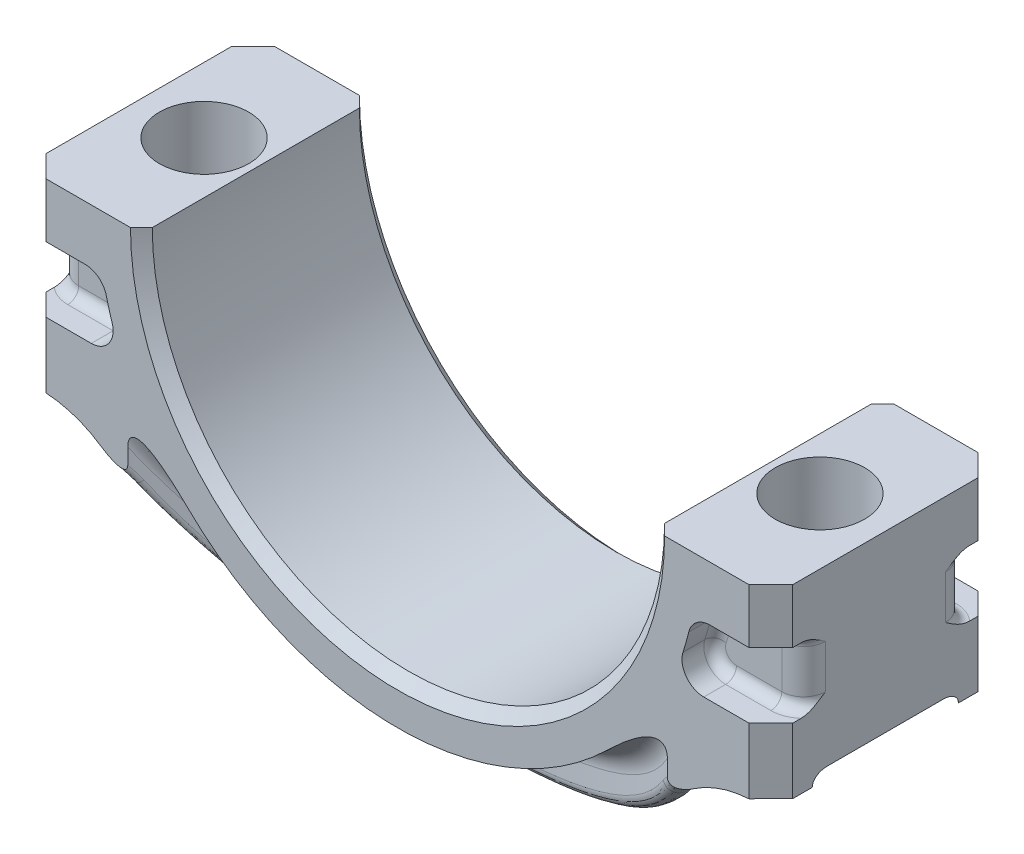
SolidWorks part; units mm, degrees
ref_plane "Front Plane" through (0, 0, 0) normal (0, 0, 1) x (1, 0, 0)
ref_plane "Top Plane" through (0, 0, 0) normal (0, 1, 0) x (1, 0, 0)
ref_plane "Right Plane" through (0, 0, 0) normal (1, 0, 0) x (0, 0, -1)
sketch "Sketch1" plane through (0, 0, 0) normal (0, 0, 1) x (1, 0, 0)
  line L0 (-32.5, 0) -> (32.5, 0)
  arc A0 (-32.5, 0) -> (32.5, 0) centre (0, 0) ccw
extrude "Boss-Extrude1" add sketch "Sketch1" along normal mid plane 21
sketch "Sketch2" plane through (0, 0, 0) normal (0, 0, 1) x (1, 0, 0)
  line L0 (0, 0) -> (0, 15.846) construction
  line L1 (0, 0) -> (-34.4872, 0) construction
  line L3 (-34.25, 0) -> (34.25, 0)
  line L4 (-34.25, 0) -> (-34.25, -17)
  line L5 (-34.25, -17) -> (34.25, -17)
  line L6 (34.25, 0) -> (34.25, -17)
  dimension "D1" = 34.25
  dimension "D2" = 68.5
  dimension "D3" = 17
extrude "Boss-Extrude2" add sketch "Sketch2" along normal mid plane 21
sketch "Sketch3" plane through (0, -17, 0) normal (0, -1, 0) x (1, 0, 0)
  line L0 (0, 0) -> (0, 28.5293) construction
  line L1 (27.6993, 10.5) -> (-27.6993, 10.5) construction
  line L2 (0, 0) -> (41.6904, 0) construction
  line L3 (-24.75, 10.5) -> (24.75, 10.5)
  line L4 (-24.75, -10.5) -> (24.75, -10.5)
  arc A0 (24.75, 10.5) -> (-24.75, 10.5) centre (0, 50.7492) cw
  arc A1 (24.75, -10.5) -> (-24.75, -10.5) centre (0, -50.7492) ccw
  dimension "D1" = 47.25
  dimension "D2" = 24.75
  dimension "D3" = 49.5
extrude "Cut-Extrude1" cut sketch "Sketch3" against normal mid plane 100
sketch "Sketch4" plane through (0, 0, 0) normal (0, 0, 1) x (1, 0, 0)
  line L0 (-27.5, 0) -> (27.5, 0)
  arc A0 (-27.5, 0) -> (27.5, 0) centre (0, 0) ccw
extrude "Boss-Extrude3" add sketch "Sketch4" along normal mid plane 21
fillet "Fillet1" radius 10 2 edges at (27.6993, -17, 0) (-27.6993, -17, 0)
sketch "Sketch5" plane through (0, 0, 0) normal (0, 0, 1) x (1, 0, 0)
  circle A0 centre (0, 0) radius 23.5
extrude "Cut-Extrude2" cut sketch "Sketch5" against normal mid plane 50
sketch "Sketch6" plane through (0, 0, 0) normal (0, 1, 0) x (1, 0, 0)
  line L0 (-35.8509, 0) -> (37.6434, 0) construction
  line L1 (0, 12.1549) -> (0, -14.3858) construction
  circle A0 centre (-28.25, 0) radius 4.1
  circle A1 centre (28.25, 0) radius 4.1
  dimension "D1" = 28.25
  dimension "D2" = 8.2
extrude "Cut-Extrude3" cut sketch "Sketch6" against normal through all
fillet "Fillet2" radius 1 2 edges at (-4.3713, -32.2047, 3.7019) (4.3713, -32.2047, -3.7019)
ref_plane "Plane1" through (0, -16, 0) normal (0, 1, 0) x (-1, 0, 0)
sketch "Sketch7" plane through (0, -16, 0) normal (0, 1, 0) x (-1, 0, 0)
  circle A0 centre (-28.25, 0) radius 9
  circle A1 centre (28.25, 0) radius 9
extrude "Cut-Extrude4" cut sketch "Sketch7" against normal through all
chamfer "Chamfer1" distance 1 angle 45 2 edges at (0, -23.5, 10.5) (0, -23.5, -10.5)
chamfer "Chamfer2" distance 2 angle 45 4 edges at (-34.25, -8.5, 10.5) (-34.25, -8.5, -10.5) (34.25, -8.5, -10.5) (34.25, -8.5, 10.5)
sketch "Sketch8" plane through (0, 0, 10.5) normal (0, 0, 1) x (1, 0, 0)
  line L0 (-24.5, 0) -> (-32.25, 0) construction
  line L1 (-36.2811, -5) -> (-27.0416, -5)
  line L2 (-36.2811, -5) -> (-36.2811, -11)
  line L3 (-36.2811, -11) -> (-25.2042, -11)
  line L4 (0, 11.6296) -> (0, -15.0203) construction
  line L5 (36.2811, -11) -> (25.2042, -11)
  line L6 (36.2811, -5) -> (36.2811, -11)
  line L7 (36.2811, -5) -> (27.0416, -5)
  arc A0 (-27.0416, -5) -> (-25.2042, -11) centre (0, 0) ccw
  arc A1 (27.0416, -5) -> (25.2042, -11) centre (0, 0) cw
  dimension "D1" = 6
  dimension "D3" = 27.5
  dimension "D2" = 5
extrude "Cut-Extrude5" cut sketch "Sketch8" against normal blind 3
mirror "Mirror1" about plane through (0, 0, 0) normal (0, 0, 1) of "Cut-Extrude5"
fillet "Fillet3" radius 2 6 edges at (34.25, -8, 7.5) (25.2042, -11, 9) (27.0416, -5, 9) (-34.25, -8, 7.5) (-25.2042, -11, 9) (-27.0416, -5, 9)
fillet "Fillet4" radius 1 14 edges at (-33.6642, -11, 6.9142) (-30.1718, -11, 7.5) (-26.478, -10.1789, 7.5) (-26.4682, -7.4623, 7.5) (-27.4224, -5.4269, 7.5) (-33.6642, -5, 6.9142) (33.6642, -5, 6.9142) (33.6642, -11, 6.9142) (30.1718, -11, 7.5) (26.478, -10.1789, 7.5) (26.4682, -7.4623, 7.5) (27.4224, -5.4269, 7.5) (-30.4537, -5, 7.5) (30.4537, -5, 7.5)
fillet "Fillet5" radius 2 6 edges at (-34.25, -8, -7.5) (-25.2042, -11, -9) (-27.0416, -5, -9) (34.25, -8, -7.5) (25.2042, -11, -9) (27.0416, -5, -9)
fillet "Fillet6" radius 1 14 edges at (33.6642, -5, -6.9142) (33.6642, -11, -6.9142) (30.1718, -11, -7.5) (26.478, -10.1789, -7.5) (26.4682, -7.4623, -7.5) (27.4224, -5.4269, -7.5) (-33.6642, -11, -6.9142) (-30.1718, -11, -7.5) (-26.478, -10.1789, -7.5) (-26.4682, -7.4623, -7.5) (-27.4224, -5.4269, -7.5) (-33.6642, -5, -6.9142) (30.4537, -5, -7.5) (-30.4537, -5, -7.5)
fillet "Fillet7" radius 1 2 edges at (19.25, -16, 0) (-19.25, -16, 0)
fillet "Fillet8" radius 2 2 edges at (1.8935, -27.4347, -3.5372) (-1.8935, -27.4347, 3.5372)
